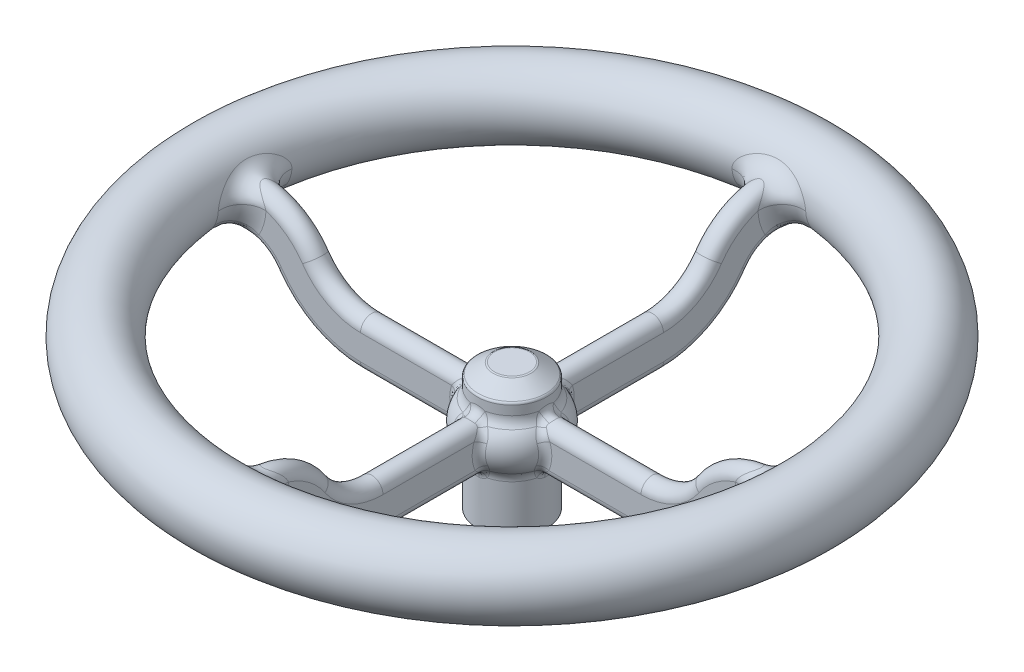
SolidWorks part; units mm, degrees
ref_plane "Front" through (0, 0, 0) normal (0, 0, 1) x (1, 0, 0)
ref_plane "Top" through (0, 0, 0) normal (0, 1, 0) x (1, 0, 0)
ref_plane "Right" through (0, 0, 0) normal (1, 0, 0) x (0, 0, -1)
sketch "Sketch1" plane through (0, 0, 0) normal (0, 0, 1) x (1, 0, 0)
  line L0 (0, 0) -> (0, -17.0257) construction
  line L1 (0, 0) -> (-12.5, 0)
  line L2 (0, 0) -> (0, 45)
  line L3 (0, 45) -> (-12.5, 45)
  line L4 (-12.5, 0) -> (-12.5, 16.802)
  line L5 (-12.5, 37.198) -> (-12.5, 45)
  arc A0 (-13.8333, 33.7987) -> (-13.8333, 20.2013) centre (-6.5, 27) ccw
  arc A1 (-12.5, 16.802) -> (-13.8333, 20.2013) centre (-17.5, 16.802) ccw
  arc A2 (-12.5, 37.198) -> (-13.8333, 33.7987) centre (-17.5, 37.198) cw
  point P11 (-12.5, 19)
  point P14 (-12.5, 35)
  dimension "D3" = 4
  dimension "D6" = 5
  dimension "D1" = 10
  dimension "D2" = 16
  dimension "D4" = 45
  dimension "D5" = 25
revolve "Hub" add sketch "Sketch1" angle 360 about L0
sketch "Sketch2" plane through (0, 0, 0) normal (1, 0, 0) x (0, 0, -1)
  line L0 (0, 31) -> (-50, 31)
  line L1 (-91.4246, 53) -> (-105, 53)
  line L2 (12.5, 45) -> (-12.5, 45) construction
  line L3 (0, 0) -> (0, 78.2352) construction
  arc A0 (-50, 31) -> (-70.7123, 42) centre (-50, 56) cw
  arc A1 (-70.7123, 42) -> (-91.4246, 53) centre (-91.4246, 28) ccw
  dimension "D1" = 25
  dimension "D2" = 14
  dimension "D3" = 22
  dimension "D4" = 55
  dimension "Handw_D" = 210
ref_plane "Plane1" through (0, 53, 105) normal (0, 0, 1) x (1, 0, 0)
sketch "Sketch3" plane through (0, 53, 105) normal (0, 0, 1) x (1, 0, 0)
  line L0 (4, 0) -> (4, -12)
  line L1 (4, -12) -> (-4, -12)
  line L2 (-4, -12) -> (-4, 0)
  arc A0 (-4, 0) -> (4, 0) centre (0, 0) cw
  dimension "D1" = 8
  dimension "D2" = 12
sweep "Spoke" add profiles "Sketch3" path "Sketch2"
fillet "Fillet1" radius 3 11 edges at (4, 30.4361, -15.3795) (-4, 19, 31.1894) (-4, 23.3225, 67.3545) (-4, 39.4813, 85.3271) (4, 19, 31.1894) (4, 13.2621, 20.6473) (4, 39.4813, 85.3271) (4, 23.3225, 67.3545) (4, 41, 98.2123) (-4, 13.7244, 21.0642) (-4, 41, 98.2123)
fillet "Fillet2" radius 3 10 edges at (0.1462, 34.9973, 13.0095) (-4, 26.8015, -16.0058) (3.7929, 32.2705, 14.5108) (-3.7253, 32.4568, 14.4061) (4, 30.4361, -15.3795) (0, 19, 13.0091) (-2.7487, 19.5624, 13.0446) (-3.9333, 21.3707, 14.2315) (3.723, 20.741, 13.8058) (2.2267, 19.2622, 12.9573)
pattern_circular "CirPattern1" count 4 over 360 about axis through (0, 0, 0) along (0, -1, 0) of "Fillet2", "Fillet1", "Spoke"
sketch "Sketch4" plane through (0, 0, 0) normal (1, 0, 0) x (0, 0, -1)
  line L0 (0, 0) -> (0, -29.0667) construction
  line L1 (0, 0) -> (0, -17.0257) construction
  circle A0 centre (-105, 53) radius 12.5
  dimension "D1" = 25
revolve "Rim" add sketch "Sketch4" angle 360 about L0
fillet "Fillet3" radius 8 44 edges at (-91.4246, 57, 0) (-91.9191, 53, -4) (-91.9191, 53, 4) (0, 57, -91.4246) (4, 53, -91.9191) (-4, 53, -91.9191) (91.4246, 57, 0) (91.9191, 53, 4) (91.9191, 53, -4) (-93.8334, 44, -4) (0, 57, 91.4246) (-4, 53, 91.9191) (4, 53, 91.9191) (4, 44, -93.8334) (93.8334, 44, 4) (93.8334, 44, -4) (101.1773, 41.094, -1.7452) (-4, 44, -93.8334) (-93.8334, 44, 4) (-4, 44, 93.8334) (4, 44, 93.8334) (-0.3475, 56.9849, 93.1515) (-4, 58.0863, 116.3497) (-2.1004, 41.2091, 100.8278) (0, 41, 101.5) (1.7452, 41.094, 101.1773) (4, 56.6026, 116.9012) (-93.1515, 56.9849, -0.3475) (-93.9254, 47.0433, -4) (-100.8278, 41.2091, -2.1004) (-101.5, 41, 0) (-101.1773, 41.094, 1.7452) (-93.2561, 48.4904, 4) (0.3475, 56.9849, -93.1515) (4, 47.0433, -93.9254) (2.1004, 41.2091, -100.8278) (0, 41, -101.5) (-1.7452, 41.094, -101.1773) (-4, 48.4904, -93.2561) (93.1515, 56.9849, 0.3475) (116.3497, 58.0863, 4) (100.8278, 41.2091, 2.1004) (101.5, 41, 0) (116.9012, 56.6026, -4)
sketch "Sketch5" plane through (3.2515, 0, -2.6271) normal (0, -1, 0) x (1, 0, 0)
  line L0 (3.073, -0.3729) -> (3.073, 5.6271)
  arc A0 (3.073, 5.6271) -> (3.073, -0.3729) centre (-3.2515, 2.6271) ccw
  circle A2 centre (-3.2515, 2.6271) radius 12.5 construction
  dimension "D_diam" = 14
  dimension "D_Flat" = 6
extrude "D-Shaped Hole" cut sketch "Sketch5" against normal blind 15
chamfer "Chamfer1" distance 4 distance2 6 1 edges at (0, 45, 12.5)
fillet "Fillet4" radius 1 2 edges at (0, 45, 6.5) (0, 41, 12.5)
